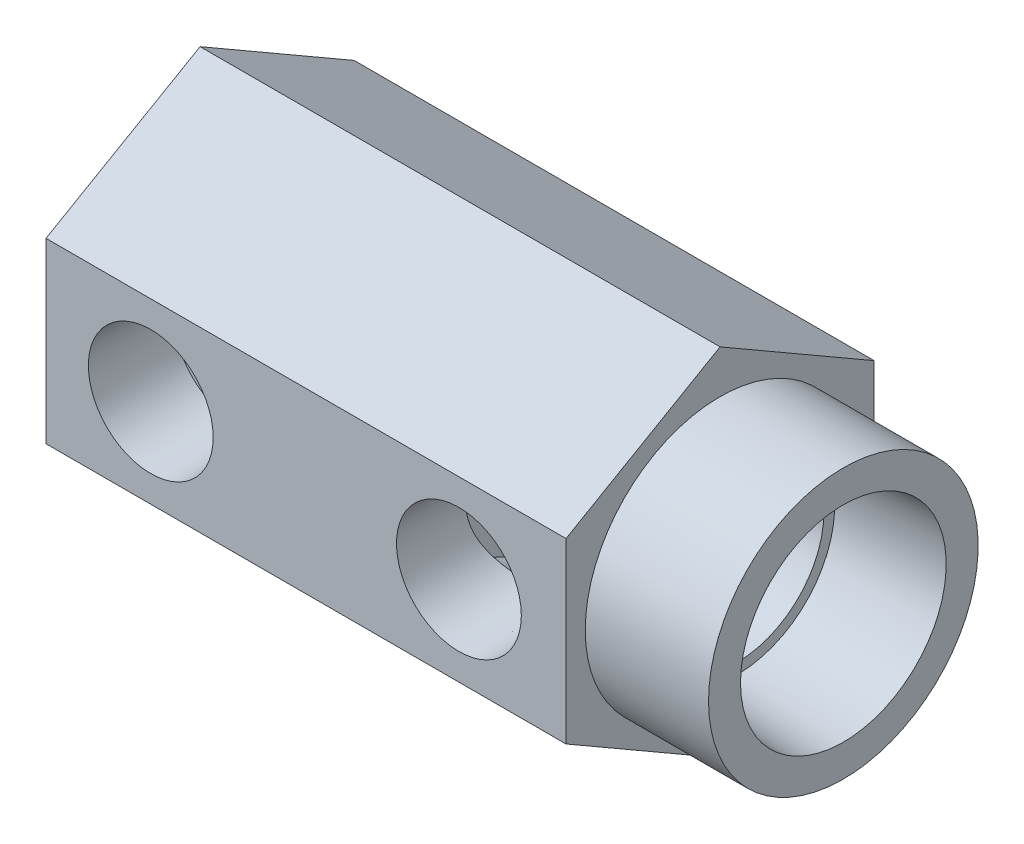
SolidWorks part; units mm, degrees
ref_plane "Front Plane" through (0, 0, 0) normal (0, 0, 1) x (1, 0, 0)
ref_plane "Top Plane" through (0, 0, 0) normal (0, 1, 0) x (1, 0, 0)
ref_plane "Right Plane" through (0, 0, 0) normal (1, 0, 0) x (0, 0, -1)
sketch "Sketch1" plane through (0, 0, 0) normal (1, 0, 0) x (0, 0, -1)
  line L0 (0, 16.1312) -> (0, -16.1312) construction
  line L1 (-12.7, -7.3323) -> (0, -14.6647)
  line L2 (0, -14.6647) -> (12.7, -7.3323)
  line L3 (12.7, -7.3323) -> (12.7, 7.3323)
  line L4 (12.7, 7.3323) -> (0, 14.6647)
  line L5 (0, 14.6647) -> (-12.7, 7.3323)
  line L6 (-12.7, 7.3323) -> (-12.7, -7.3323)
  circle A0 centre (0, 0) radius 12.7 construction
  dimension "D1" = 25.4
extrude "Boss-Extrude1" add sketch "Sketch1" along normal blind 42.8625 separate body
sketch "Sketch2" plane through (0, 0, 0) normal (-1, 0, 0) x (0, 0, 1)
  circle A1 centre (0, 0) radius 11.1125
  dimension "D1" = 22.225
extrude "Boss-Extrude2" add sketch "Sketch2" against normal blind 53.0225
sketch "Sketch3" plane through (0, 0, 0) normal (0, 0, 1) x (1, 0, 0)
  line L0 (53.0225, -11.1125) -> (53.0225, 11.1125) construction
  line L1 (53.0225, 0) -> (53.0225, 8.4772)
  line L2 (27.6225, 0) -> (27.6225, 7.1374)
  line L6 (53.0225, 8.4772) -> (44.2849, 8.0193)
  line L7 (44.2849, 7.1374) -> (44.2849, 8.0193)
  line L8 (44.2849, 7.1374) -> (27.6225, 7.1374)
  line L9 (0, 0) -> (50000, 0) construction
  line L10 (53.0225, 0) -> (27.6225, 0)
  dimension "D1" = 14.2748
  dimension "D2" = 16.9545
  dimension "D3" = 3
  dimension "D4" = 8.7376
  dimension "D5" = 25.4
revolve "Cut-Revolve1" cut sketch "Sketch3" angle 360 about L9
hole_wizard "1/8 NPT Tapped Hole1" positions "Sketch5" profile "Sketch4" size "1/8" standard "Ansi Inch"
sketch "Sketch5" plane through (0, 0, 12.7) normal (0, 0, 1) x (1, 0, 0)
  line L0 (13.97, 0) -> (-13.97, 0) construction
  line L1 (0, -13.97) -> (0, 13.97) construction
  point P0 (8.636, 0)
  point P1 (34.036, 0)
  dimension "D1" = 8.636
  dimension "D2" = 25.4
sketch "Sketch4" plane through (8.636, 0, 12.7) normal (1, 0, 0) x (0, -1, 0)
  line L0 (0, 0) -> (0, 18.4085)
  line L1 (4.2164, 15.875) -> (0, 18.4085)
  line L2 (-4.2164, 15.875) -> (0, 18.4085) construction
  line L3 (4.2164, 15.875) -> (4.2164, 6.924)
  line L4 (4.2164, 6.924) -> (4.9362, 6.924)
  line L5 (4.9362, 6.924) -> (5.1435, 0)
  line L6 (-4.9362, 6.924) -> (-5.1435, 0) construction
  line L7 (5.1435, 0) -> (0, 0)
  line L8 (0, -6.35) -> (0, 107.95) construction
  line L11 (-4.2164, 6.924) -> (-4.9362, 6.924) construction
  dimension "Tap Drill Dia." = 8.4328
  dimension "Tap Drill Depth" = 15.875
  dimension "Thread Dia." = 10.287
  dimension "Thread Angle" = 3.43
  dimension "Thread Depth" = 6.924
  dimension "Drill Angle" = 118
hole_wizard "1/8 NPT Tapped Hole2" positions "Sketch7" profile "Sketch6" size "1/8" standard "Ansi Inch"
sketch "Sketch7" plane through (0, 0, -12.7) normal (0, 0, -1) x (-1, 0, 0)
  circle A0 centre (-8.636, 0) radius 5.1435 construction
  point P0 (-8.636, 0)
sketch "Sketch6" plane through (8.636, 0, -12.7) normal (1, 0, 0) x (0, 1, 0)
  line L0 (0, 0) -> (0, 18.4085)
  line L1 (4.2164, 15.875) -> (0, 18.4085)
  line L2 (-4.2164, 15.875) -> (0, 18.4085) construction
  line L3 (4.2164, 15.875) -> (4.2164, 6.924)
  line L4 (4.2164, 6.924) -> (4.9362, 6.924)
  line L5 (4.9362, 6.924) -> (5.1435, 0)
  line L6 (-4.9362, 6.924) -> (-5.1435, 0) construction
  line L7 (5.1435, 0) -> (0, 0)
  line L8 (0, -6.35) -> (0, 107.95) construction
  line L11 (-4.2164, 6.924) -> (-4.9362, 6.924) construction
  dimension "Tap Drill Dia." = 8.4328
  dimension "Tap Drill Depth" = 15.875
  dimension "Thread Dia." = 10.287
  dimension "Thread Angle" = 3.43
  dimension "Thread Depth" = 6.924
  dimension "Drill Angle" = 118
hole_wizard "I (0.272) Diameter Hole1" positions "Sketch9" profile "Sketch8" hole size "I" standard "Ansi Inch"
sketch "Sketch9" plane through (53.0225, 0, 0) normal (1, 0, 0) x (0, 0, -1)
  circle A0 centre (0, 0) radius 8.4772 construction
  point P0 (0, 0)
sketch "Sketch8" plane through (53.0225, 0, 0) normal (0, 1, 0) x (0, 0, -1)
  line L0 (0, 0) -> (0, 46.5256)
  line L1 (0, 46.5256) -> (3.4544, 44.45)
  line L2 (3.4544, 44.45) -> (3.4544, 0)
  line L5 (3.4544, 0) -> (0, 0)
  line L10 (0, 46.5256) -> (-3.4544, 44.45) construction
  line L11 (0, -6.35) -> (0, 107.95) construction
  dimension "Hole Dia." = 6.9088
  dimension "Hole Depth" = 44.45
  dimension "Drill Angle" = 118
hole_wizard "5/16 (0.3125) Diameter Hole1" positions "Sketch11" profile "Sketch10" hole size "5/16" standard "Ansi Inch"
sketch "Sketch11" plane through (53.0225, 0, 0) normal (1, 0, 0) x (0, 0, -1)
  circle A0 centre (0, 0) radius 8.4772 construction
  point P0 (0, 0)
sketch "Sketch10" plane through (53.0225, 0, 0) normal (0, 1, 0) x (0, 0, -1)
  line L0 (0, 0) -> (0, 38.9607)
  line L1 (0, 38.9607) -> (3.9687, 36.576)
  line L2 (3.9687, 36.576) -> (3.9687, 0)
  line L5 (3.9687, 0) -> (0, 0)
  line L10 (0, 38.9607) -> (-3.9688, 36.576) construction
  line L11 (0, -6.35) -> (0, 107.95) construction
  dimension "Hole Dia." = 7.9375
  dimension "Hole Depth" = 36.576
  dimension "Drill Angle" = 118
